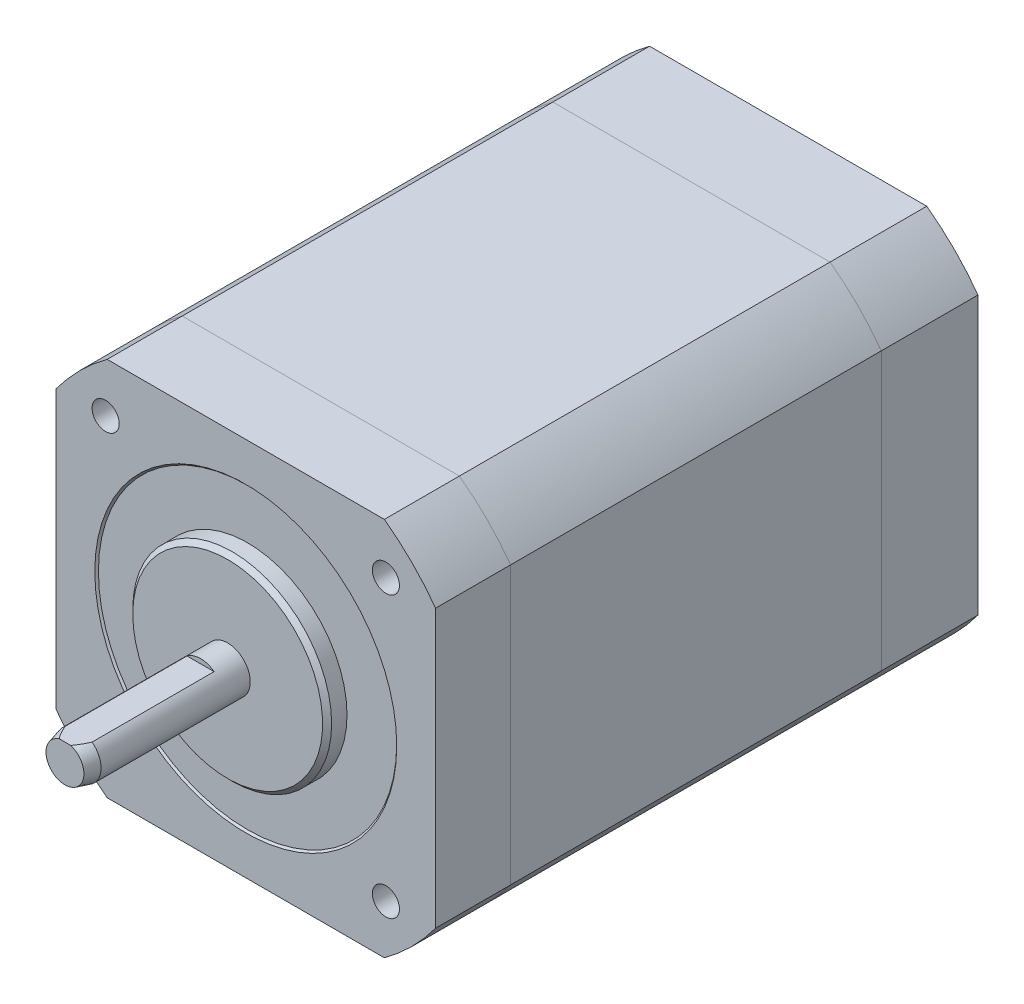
SolidWorks part; units mm, degrees
ref_plane "正面" through (0, 0, 0) normal (0, 0, 1) x (1, 0, 0)
ref_plane "平面" through (0, 0, 0) normal (0, 1, 0) x (1, 0, 0)
ref_plane "右側面" through (0, 0, 0) normal (1, 0, 0) x (0, 0, -1)
sketch "ｽｹｯﾁ1" plane through (0, 0, 0) normal (0, 0, 1) x (1, 0, 0)
  circle A0 centre (0, 0) radius 2.5
  dimension "D1" = 5
extrude "押し出し1" add sketch "ｽｹｯﾁ1" along normal blind 18
sketch "ｽｹｯﾁ2" plane through (0, 0, 0) normal (0, 0, -1) x (-1, 0, 0)
  circle A0 centre (0, 0) radius 11
  dimension "D1" = 22
extrude "押し出し2" add sketch "ｽｹｯﾁ2" along normal blind 2
sketch "ｽｹｯﾁ3" plane through (0, 0, -2) normal (0, 0, -1) x (-1, 0, 0)
  line L1 (-21, 21) -> (21, 21)
  line L2 (-21, 21) -> (-21, -21)
  line L3 (-21, -21) -> (21, -21)
  line L4 (21, 21) -> (21, -21)
  line L5 (-21, 21) -> (21, -21) construction
  line L6 (-21, -21) -> (21, 21) construction
  point P0 (0, 0)
  point P6 (0, 0)
  dimension "D1" = 42
  dimension "D2" = 42
extrude "押し出し3" add sketch "ｽｹｯﾁ3" along normal blind 8.3
sketch "Sketch8" plane through (0, 0, -2) normal (0, 0, 1) x (1, 0, 0)
  circle A0 centre (0, 0) radius 26
  dimension "D1" = 52
extrude "Extrude8" cut sketch "Sketch8" against normal blind 34 flip side to cut
sketch "Sketch9" plane through (0, 0, -10.3) normal (0, 0, -1) x (-1, 0, 0)
  line L4 (-21, 15.3297) -> (-21, -15.3297) construction
  line L5 (-15.3297, -21) -> (15.3297, -21) construction
  line L6 (21, -15.3297) -> (21, 15.3297) construction
  line L7 (15.3297, 21) -> (-15.3297, 21) construction
  line L8 (-21, 15.3297) -> (-21, -15.3297)
  line L9 (-15.3297, -21) -> (15.3297, -21)
  line L10 (21, -15.3297) -> (21, 15.3297)
  line L11 (15.3297, 21) -> (-15.3297, 21)
  arc A1 (21, 15.3297) -> (15.3297, 21) centre (0, 0) ccw
  arc A2 (-15.3297, 21) -> (-21, 15.3297) centre (0, 0) ccw
  arc A3 (-21, -15.3297) -> (-15.3297, -21) centre (0, 0) ccw
  arc A4 (15.3297, -21) -> (21, -15.3297) centre (0, 0) ccw
  dimension "D1" = 52
extrude "Extrude9" add sketch "Sketch9" along normal blind 41 separate body
sketch "Sketch14" plane through (0, 0, -2) normal (0, 0, 1) x (1, 0, 0)
  line L5 (15.5, -15.5) -> (-15.5, 15.5) construction
  line L6 (15.5, 15.5) -> (-15.5, -15.5) construction
  circle A0 centre (-15.5, 15.5) radius 1.5
  circle A1 centre (15.5, 15.5) radius 1.5
  circle A2 centre (15.5, -15.5) radius 1.5
  circle A3 centre (-15.5, -15.5) radius 1.5
  point P0 (0, 0)
  dimension "D3" = 3
  dimension "D4" = 3
  dimension "D5" = 3
  dimension "D6" = 3
  dimension "D1" = 31
  dimension "D2" = 31
  dimension "D7" = 15.5
  dimension "D8" = 15.5
  dimension "D9" = 31
  dimension "D10" = 31
extrude "Extrude13" cut sketch "Sketch14" against normal blind 4.5
sketch "Sketch11" plane through (0, 0, -51.3) normal (0, 0, -1) x (-1, 0, 0)
  line L15 (-15.3297, -21) -> (15.3297, -21)
  line L16 (21, -15.3297) -> (21, 15.3297)
  line L17 (15.3297, 21) -> (-15.3297, 21)
  line L18 (-21, 15.3297) -> (-21, -15.3297)
  line L19 (-15.3297, -21) -> (15.3297, -21)
  line L20 (21, -15.3297) -> (21, 15.3297)
  line L21 (15.3297, 21) -> (-15.3297, 21)
  line L23 (-21, 15.3297) -> (-21, -15.3297)
  arc A8 (-21, -15.3297) -> (-15.3297, -21) centre (0, 0) ccw
  arc A9 (15.3297, -21) -> (21, -15.3297) centre (0, 0) ccw
  arc A10 (21, 15.3297) -> (15.3297, 21) centre (0, 0) ccw
  arc A11 (-15.3297, 21) -> (-21, 15.3297) centre (0, 0) ccw
  arc A12 (-21, -15.3297) -> (-15.3297, -21) centre (0, 0) ccw
  arc A13 (15.3297, -21) -> (21, -15.3297) centre (0, 0) ccw
  arc A14 (21, 15.3297) -> (15.3297, 21) centre (0, 0) ccw
  arc A15 (-15.3297, 21) -> (-21, 15.3297) centre (0, 0) ccw
  dimension "D1" = 0
extrude "Extrude11" add sketch "Sketch11" along normal blind 10.7 separate body
sketch "Sketch2" plane through (0, 0, 18) normal (0, 0, 1) x (1, 0, 0)
  line L1 (-4.7278, 5.1185) -> (3.4221, 5.1185)
  line L2 (-4.7278, 5.1185) -> (-4.7278, 2)
  line L3 (-4.7278, 2) -> (3.4221, 2)
  line L4 (3.4221, 5.1185) -> (3.4221, 2)
  dimension "D1" = 2
extrude "Extrude2" cut sketch "Sketch2" against normal blind 15
sketch "Sketch6" plane through (0, 0, -2) normal (0, 0, 1) x (1, 0, 0)
  circle A0 centre (0, 0) radius 16.5
  circle A1 centre (0, 0) radius 11 construction
  circle A2 centre (0, 0) radius 11
  dimension "D2" = 33
extrude "Extrude6" cut sketch "Sketch6" against normal blind 0.2
chamfer "Chamfer2" distance 0.5 angle 45 1 edges at (-11, 0, 0)
chamfer "Chamfer7" distance 0.2 angle 45 1 edges at (16.5, 0, -2)
sketch "Sketch13" plane through (0, -21, 0) normal (0, -1, 0) x (1, 0, 0)
  line L1 (-8.4, -51.8) -> (8.4, -51.8)
  line L2 (-8.4, -51.8) -> (-8.4, -62)
  line L3 (-8.4, -62) -> (8.4, -62)
  line L4 (8.4, -51.8) -> (8.4, -62)
  line L6 (15.3297, -62) -> (-15.3297, -62) construction
  dimension "D1" = 10.2
  dimension "D2" = 16.8
  dimension "D3" = 8.4
extrude "Extrude12" add sketch "Sketch13" along normal blind 4.6 separate body
sketch "Sketch15" plane through (0, 0, -62) normal (0, 0, -1) x (-1, 0, 0)
  circle A0 centre (0, 0) radius 2.5
  dimension "D1" = 5
extrude "Extrude14" add sketch "Sketch15" along normal blind 15
chamfer "Chamfer5" distance 1.5 angle 15 1 edges at (0, -2.5, 18)
chamfer "Chamfer8" distance 1.5 angle 15 1 edges at (-2.5, 0, -77)
sketch "Sketch16" plane through (0, 0, -77) normal (0, 0, -1) x (-1, 0, 0)
  line L1 (-5.9696, 9.099) -> (5.9696, 9.099)
  line L2 (-5.9696, 9.099) -> (-5.9696, 2)
  line L3 (-5.9696, 2) -> (5.9696, 2)
  line L4 (5.9696, 9.099) -> (5.9696, 2)
  line L5 (-5.9696, 9.099) -> (5.9696, 2) construction
  line L6 (-5.9696, 2) -> (5.9696, 9.099) construction
  point P0 (0, 5.5495)
  dimension "D1" = 2
extrude "Extrude15" cut sketch "Sketch16" against normal blind 15
